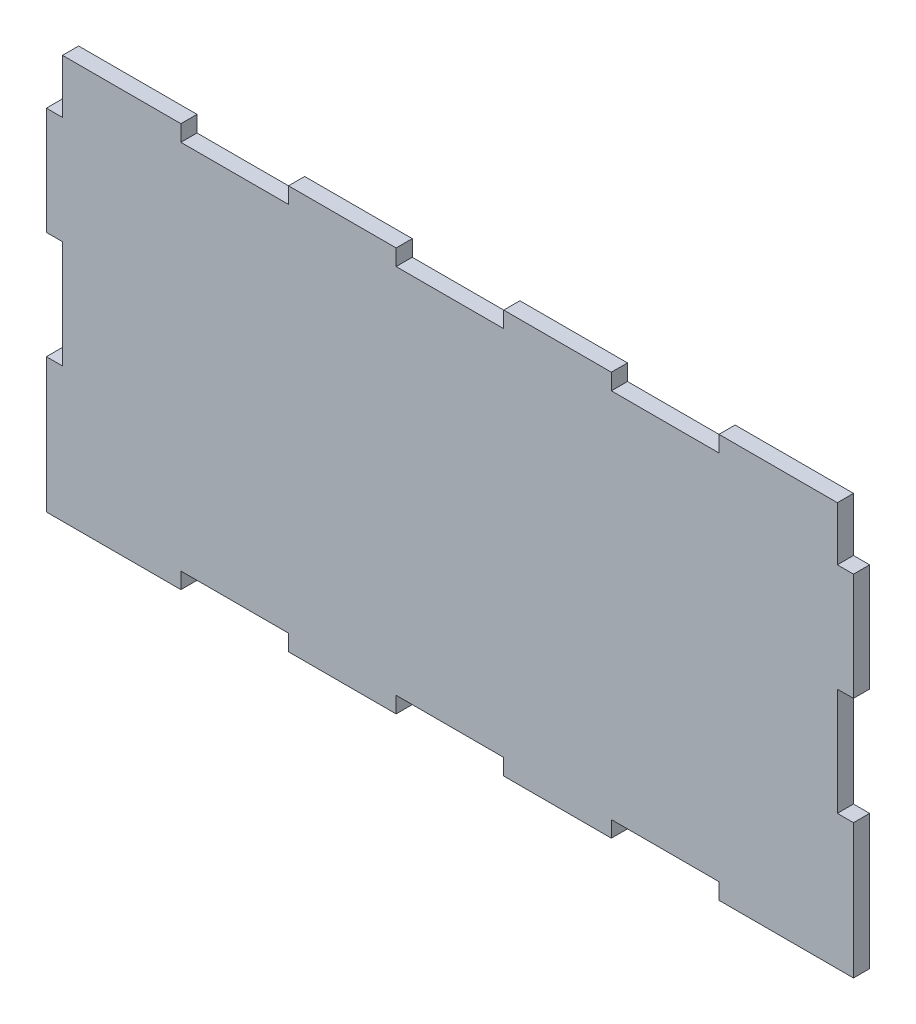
SolidWorks part; units mm, degrees
ref_plane "Alzado" through (0, 0, 0) normal (0, 0, 1) x (1, 0, 0)
ref_plane "Planta" through (0, 0, 0) normal (0, 1, 0) x (1, 0, 0)
ref_plane "Vista lateral" through (0, 0, 0) normal (1, 0, 0) x (0, 0, -1)
sketch "Sketch1" plane through (0, 0, 0) normal (0, 0, 1) x (1, 0, 0)
  line L1 (0, 0) -> (600, 0)
  line L2 (0, 0) -> (0, 300)
  line L3 (0, 300) -> (600, 300)
  line L4 (600, 0) -> (600, 300)
  dimension "D1" = 600
  dimension "D2" = 300
extrude "Boss-Extrude1" add sketch "Sketch1" along normal blind 12
sketch "Sketch2" plane through (0, 0, 12) normal (0, 0, 1) x (1, 0, 0)
  line L0 (0, 0) -> (600, 0) construction
  line L1 (100, 0) -> (180, 0)
  line L2 (100, 0) -> (100, 12)
  line L3 (100, 12) -> (180, 12)
  line L4 (180, 0) -> (180, 12)
  line L5 (0, 300) -> (0, 0) construction
  line L6 (260, 0) -> (340, 0)
  line L7 (260, 0) -> (260, 12)
  line L8 (260, 12) -> (340, 12)
  line L9 (340, 0) -> (340, 12)
  line L10 (420, 0) -> (500, 0)
  line L11 (420, 0) -> (420, 12)
  line L12 (420, 12) -> (500, 12)
  line L13 (500, 0) -> (500, 12)
  line L14 (0, 150) -> (600, 150) construction
  line L15 (300, 0) -> (300, 300) construction
  line L16 (0, 100) -> (12, 100)
  line L17 (0, 100) -> (0, 180)
  line L18 (0, 180) -> (12, 180)
  line L19 (12, 100) -> (12, 180)
  line L20 (0, 260) -> (12, 260)
  line L21 (0, 260) -> (0, 340)
  line L22 (0, 340) -> (12, 340)
  line L23 (12, 260) -> (12, 340)
  line L24 (600, 300) -> (0, 300) construction
  line L25 (600, 0) -> (600, 300) construction
  line L26 (500, 300) -> (500, 288)
  line L27 (420, 288) -> (500, 288)
  line L28 (420, 300) -> (420, 288)
  line L29 (420, 300) -> (500, 300)
  line L30 (340, 300) -> (340, 288)
  line L31 (260, 288) -> (340, 288)
  line L32 (260, 300) -> (260, 288)
  line L33 (260, 300) -> (340, 300)
  line L34 (180, 300) -> (180, 288)
  line L35 (100, 288) -> (180, 288)
  line L36 (100, 300) -> (100, 288)
  line L37 (100, 300) -> (180, 300)
  line L38 (588, 260) -> (588, 340)
  line L39 (600, 340) -> (588, 340)
  line L40 (600, 260) -> (600, 340)
  line L41 (600, 260) -> (588, 260)
  line L42 (588, 100) -> (588, 180)
  line L43 (600, 180) -> (588, 180)
  line L44 (600, 100) -> (600, 180)
  line L45 (600, 100) -> (588, 100)
  point P14 (100, 6)
extrude "Cut-Extrude1" cut sketch "Sketch2" against normal blind 12
equation "\"mat\"= 12"
equation "\"pes\"= 80"
equation "\"sep\"= 80"
equation "\"D1@Boss-Extrude1\"=\"mat\""
equation "\"D1@Sketch2\"=\"mat\""
equation "\"D2@Sketch2\"=\"mat\""
equation "\"D3@Sketch2\"=\"mat\""
equation "\"D4@Sketch2\"=\"pes\""
equation "\"D5@Sketch2\"=\"pes\""
equation "\"D6@Sketch2\"=\"pes\""
equation "\"D8@Sketch2\"=\"sep\""
equation "\"D9@Sketch2\"=\"sep\""
equation "\"D11@Sketch2\"=\"mat\""
equation "\"D12@Sketch2\"=\"pes\""
equation "\"D13@Sketch2\"=\"pes\""
equation "\"D14@Sketch2\"=\"sep\""
equation "\"D15@Sketch2\"=\"mat\""
equation "\"D1@Cut-Extrude1\"=\"mat\""
